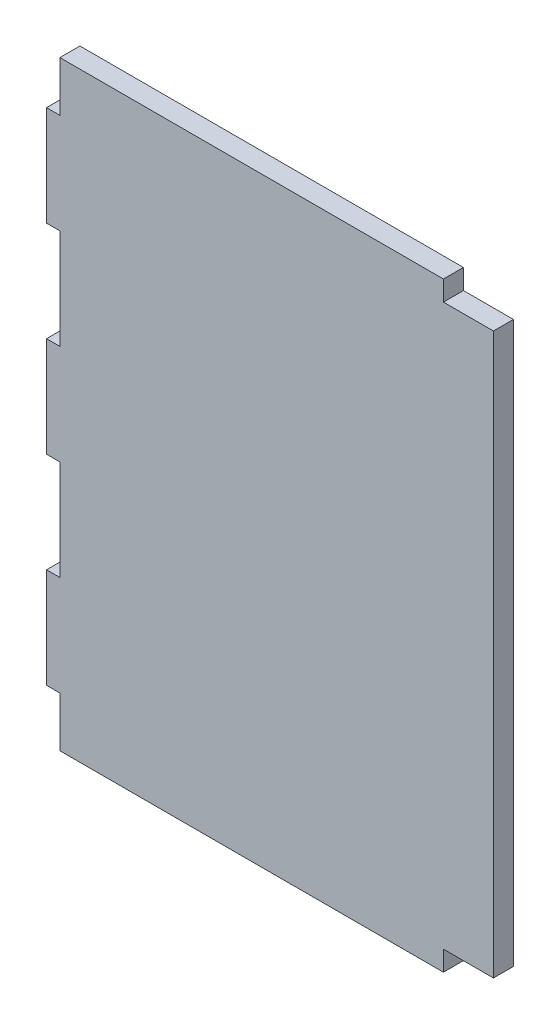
SolidWorks part; units mm, degrees
ref_plane "Front Plane" through (0, 0, 0) normal (0, 0, 1) x (1, 0, 0)
ref_plane "Top Plane" through (0, 0, 0) normal (0, 1, 0) x (1, 0, 0)
ref_plane "Right Plane" through (0, 0, 0) normal (1, 0, 0) x (0, 0, -1)
sketch "Sketch1" plane through (0, 0, 0) normal (0, 0, 1) x (1, 0, 0)
  line L0 (0, 165) -> (0, 180) construction
  line L1 (0, 0) -> (130, 0)
  line L2 (0, 0) -> (0, 180)
  line L3 (0, 180) -> (130, 180)
  line L4 (130, 0) -> (130, 180)
  line L5 (0, 165) -> (-4, 165)
  line L6 (0, 165) -> (0, 135)
  line L7 (0, 135) -> (-4, 135)
  line L8 (-4, 165) -> (-4, 135)
  line L9 (0, 15) -> (-4, 15)
  line L10 (0, 15) -> (0, 45)
  line L11 (0, 45) -> (-4, 45)
  line L12 (-4, 15) -> (-4, 45)
  line L13 (0, 105) -> (-4, 105)
  line L14 (0, 105) -> (0, 75)
  line L15 (0, 75) -> (-4, 75)
  line L16 (-4, 105) -> (-4, 75)
  line L17 (0, 180) -> (-3.7137, 180) construction
  line L18 (-2.0926, 165) -> (-2.0926, 180) construction
  line L19 (0, 0) -> (-3.7137, 0) construction
  line L20 (-2.0926, 15) -> (-2.0926, 0) construction
  line L21 (130, 90) -> (54.4606, 90) construction
  line L22 (130, 180) -> (115, 180)
  line L23 (130, 180) -> (130, 174)
  line L24 (130, 174) -> (115, 174)
  line L25 (115, 180) -> (115, 174)
  line L26 (115, 0) -> (115, 6)
  line L27 (130, 6) -> (115, 6)
extrude "Boss-Extrude1" add sketch "Sketch1" along normal blind 6 contours L27 L4 L24 L25 L3 L2 L1 L26 | L5 L8 L7 L2 | L13 L16 L15 L2 | L12 L9 L2 L11
equation "\"sheetThickness\"=0.63mm"
equation "\"flange\"= 11mm"
equation "\"baffleCutWidth\"= 28.58mm"
equation "\"baffleCutLength\"= 146.22mm"
equation "\"metalLength\" = 156.28mm"
equation "\"metalWidth\" = 35.5mm"
equation "\"pitch\" = 42mm"
equation "\"cabDepth\" = 130mm "
equation "\"D9@Sketch1\"=\"cabDepth\""
